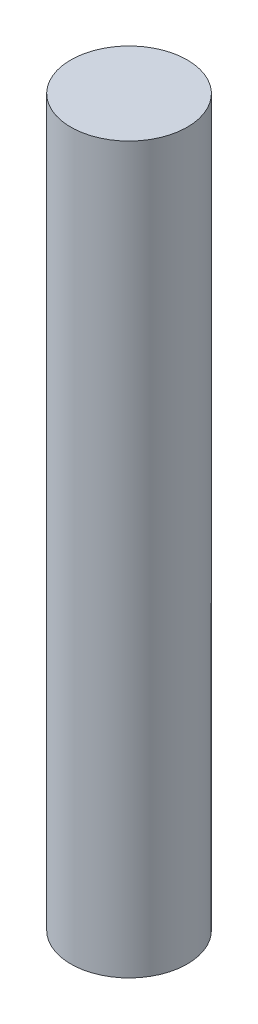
SolidWorks part; units mm, degrees
ref_plane "Plan de face" through (0, 0, 0) normal (0, 0, 1) x (1, 0, 0)
ref_plane "Plan de dessus" through (0, 0, 0) normal (0, 1, 0) x (1, 0, 0)
ref_plane "Plan de droite" through (0, 0, 0) normal (1, 0, 0) x (0, 0, -1)
sketch "Esquisse2" plane through (0, 0, 0) normal (1, 0, 0) x (0, 0, -1)
  line L0 (139, -172.2194) -> (139, -123.1498) construction
  line L2 (139, -125.0826) -> (137, -125.0826)
  line L3 (137, -125.0826) -> (137, -149.9633)
  line L4 (137, -149.9633) -> (139, -149.9633)
  line L5 (139, -125.0826) -> (139, -149.9633)
revolve "Révolution1" add sketch "Esquisse2" angle 360 about L0
